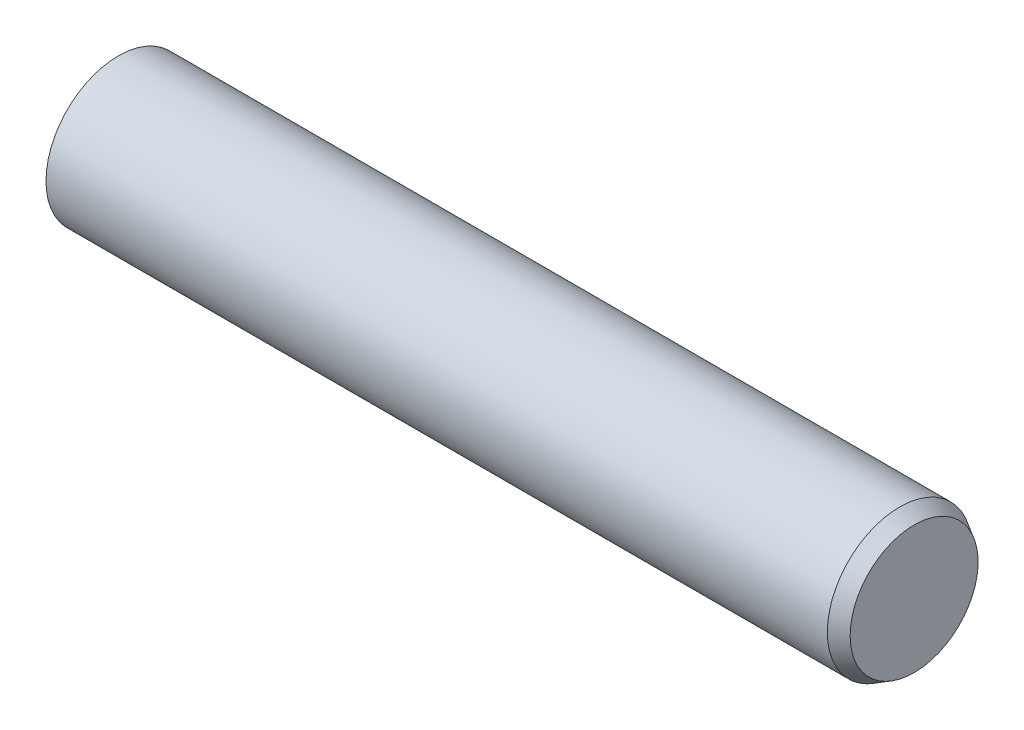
SolidWorks part; units mm, degrees
ref_plane "Face" through (0, 0, 0) normal (0, 0, 1) x (1, 0, 0)
ref_plane "Dessus" through (0, 0, 0) normal (0, 1, 0) x (1, 0, 0)
ref_plane "Droite" through (0, 0, 0) normal (1, 0, 0) x (0, 0, -1)
sketch "Esquisse1" plane through (0, 0, 0) normal (0, 0, 1) x (1, 0, 0)
  line L0 (0, 0) -> (191.7089, 0) construction
  line L1 (0, 0) -> (0, 7.5)
  line L2 (0, 7.5) -> (3, 7.5)
  line L3 (3, 7.5) -> (3, 15)
  line L4 (3, 15) -> (168, 15)
  line L5 (168, 15) -> (168, 0)
  line L6 (168, 0) -> (0, 0)
  dimension "D1" = 15
  dimension "D2" = 7.5
  dimension "D3" = 3
  dimension "D4" = 168
revolve "Révolution1" add sketch "Esquisse1" angle 360 about L0
chamfer "Chanfrein1" distance 3 angle 30 1 edges at (168, 0, 15)
